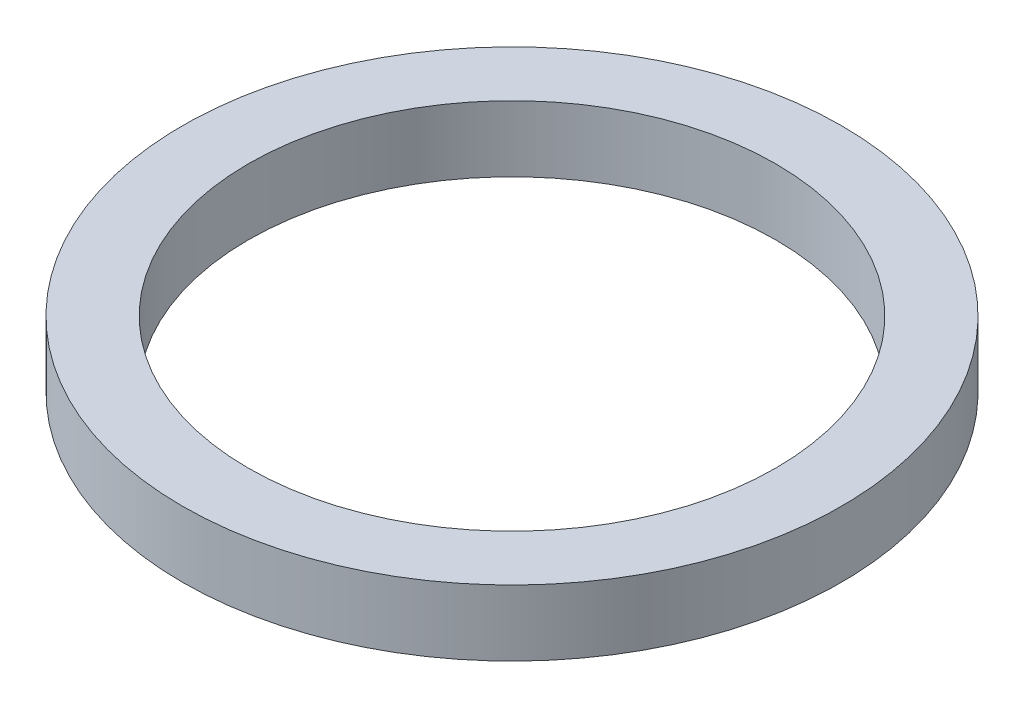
SolidWorks part; units mm, degrees
ref_plane "Front Plane" through (0, 0, 0) normal (0, 0, 1) x (1, 0, 0)
ref_plane "Top Plane" through (0, 0, 0) normal (0, 1, 0) x (1, 0, 0)
ref_plane "Right Plane" through (0, 0, 0) normal (1, 0, 0) x (0, 0, -1)
sketch "Sketch1" plane through (0, 0, 0) normal (0, 1, 0) x (1, 0, 0)
  circle A0 centre (0, 0) radius 40
  circle A1 centre (0, 0) radius 50
extrude "Boss-Extrude1" add sketch "Sketch1" along normal blind 10
